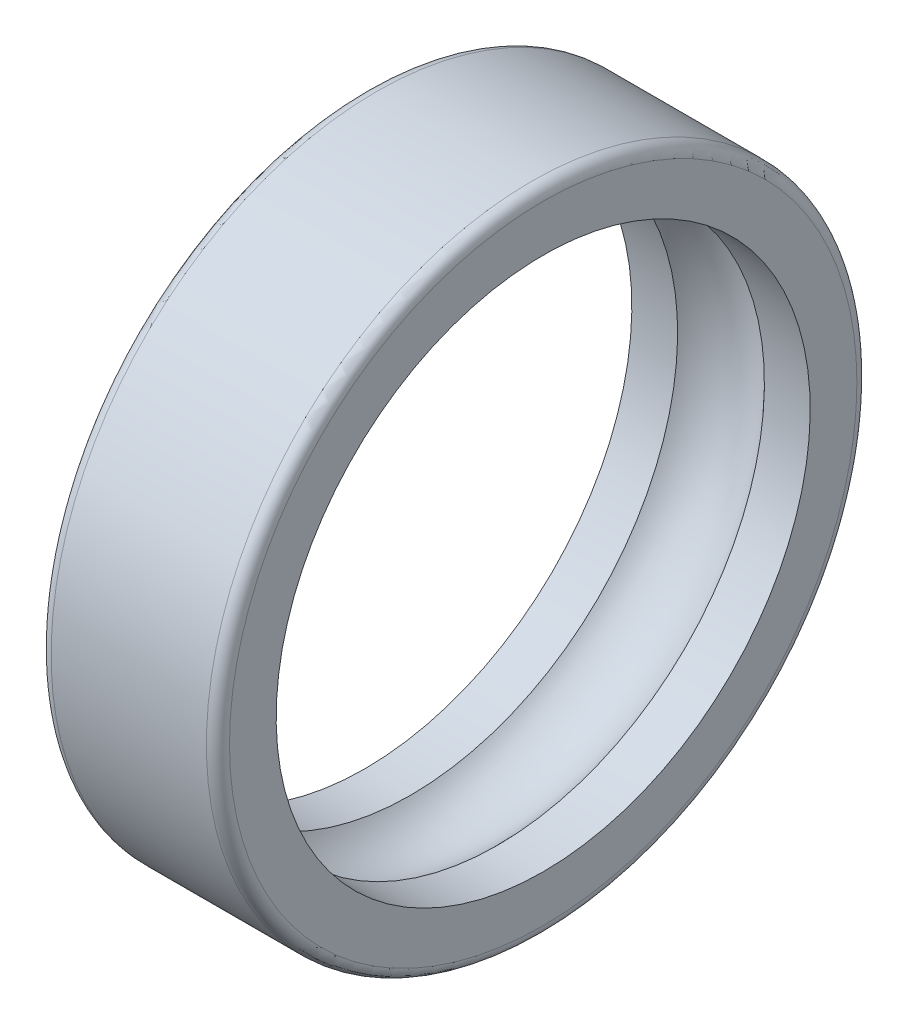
SolidWorks part; units mm, degrees
ref_plane "Plan de face" through (0, 0, 0) normal (0, 0, 1) x (1, 0, 0)
ref_plane "Plan de dessus" through (0, 0, 0) normal (0, 1, 0) x (1, 0, 0)
ref_plane "Plan de droite" through (0, 0, 0) normal (1, 0, 0) x (0, 0, -1)
sketch "Esquisse1" plane through (0, 0, 0) normal (0, 0, 1) x (1, 0, 0)
  line L0 (8.5, 31) -> (8.5, 12.5) construction
  line L1 (1.1, 31) -> (15.9, 31)
  line L2 (0, 29.9) -> (0, 13.6) construction
  line L3 (1.1, 12.5) -> (15.9, 12.5) construction
  line L4 (17, 29.9) -> (17, 13.6) construction
  line L5 (17, 25.45) -> (12.6367, 25.45)
  line L6 (17, 18.05) -> (0, 18.05) construction
  line L7 (0, 0) -> (17, 0) construction
  line L8 (17, 29.9) -> (17, 25.45)
  line L9 (0, 25.45) -> (0, 29.9)
  line L10 (4.3633, 25.45) -> (0, 25.45)
  arc A1 (0, 13.6) -> (1.1, 12.5) centre (1.1, 13.6) ccw construction
  arc A2 (1.1, 31) -> (0, 29.9) centre (1.1, 29.9) ccw
  arc A3 (17, 29.9) -> (15.9, 31) centre (15.9, 29.9) ccw
  arc A4 (15.9, 12.5) -> (17, 13.6) centre (15.9, 13.6) ccw construction
  arc A5 (12.6367, 25.45) -> (4.3633, 25.45) centre (8.5, 21.75) ccw
  dimension "D4" = 1.1
  dimension "D5" = 11.1
  dimension "D1" = 12.5
  dimension "D2" = 31
  dimension "D3" = 17
  dimension "D6" = 18.05
  dimension "D7" = 25.45
revolve "Révolution1" add sketch "Esquisse1" angle 360 about L7
